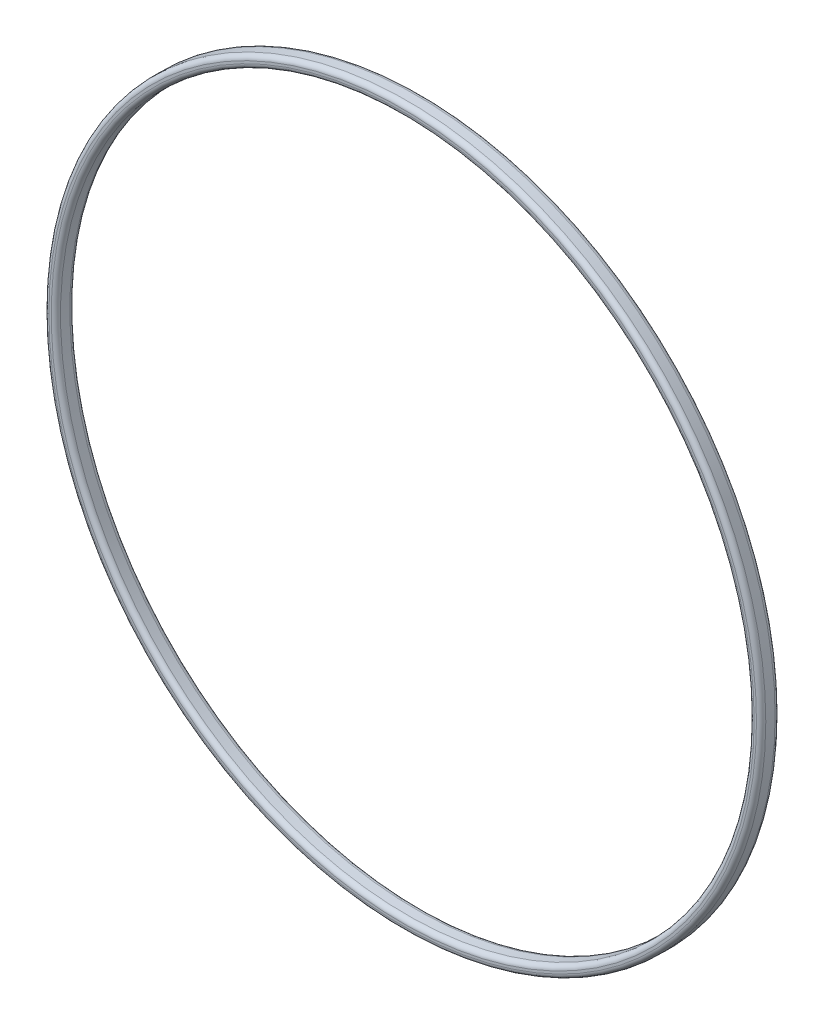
SolidWorks part; units mm, degrees
ref_plane "Plan de face" through (0, 0, 0) normal (0, 0, 1) x (1, 0, 0)
ref_plane "Plan de dessus" through (0, 0, 0) normal (0, 1, 0) x (1, 0, 0)
ref_plane "Plan de droite" through (0, 0, 0) normal (1, 0, 0) x (0, 0, -1)
sketch "Esquisse1" plane through (0, 0, 0) normal (1, 0, 0) x (0, 0, -1)
  line L0 (-20.8244, 0) -> (21.7431, 0) construction
  line L2 (1.4594, 77) -> (3.4594, 77)
  line L3 (0.4594, 76) -> (0.4594, 75.5)
  line L4 (1.4594, 74.5) -> (3.4594, 74.5)
  line L5 (4.4594, 76) -> (4.4594, 75.5)
  arc A0 (3.4594, 74.5) -> (4.4594, 75.5) centre (3.4594, 75.5) ccw
  arc A1 (3.4594, 77) -> (4.4594, 76) centre (3.4594, 76) cw
  arc A2 (1.4594, 77) -> (0.4594, 76) centre (1.4594, 76) ccw
  arc A3 (0.4594, 75.5) -> (1.4594, 74.5) centre (1.4594, 75.5) ccw
  dimension "D4" = 1
  dimension "D1" = 149
  dimension "D2" = 154
  dimension "D3" = 4
revolve "Révolution1" add sketch "Esquisse1" angle 360 about L0
